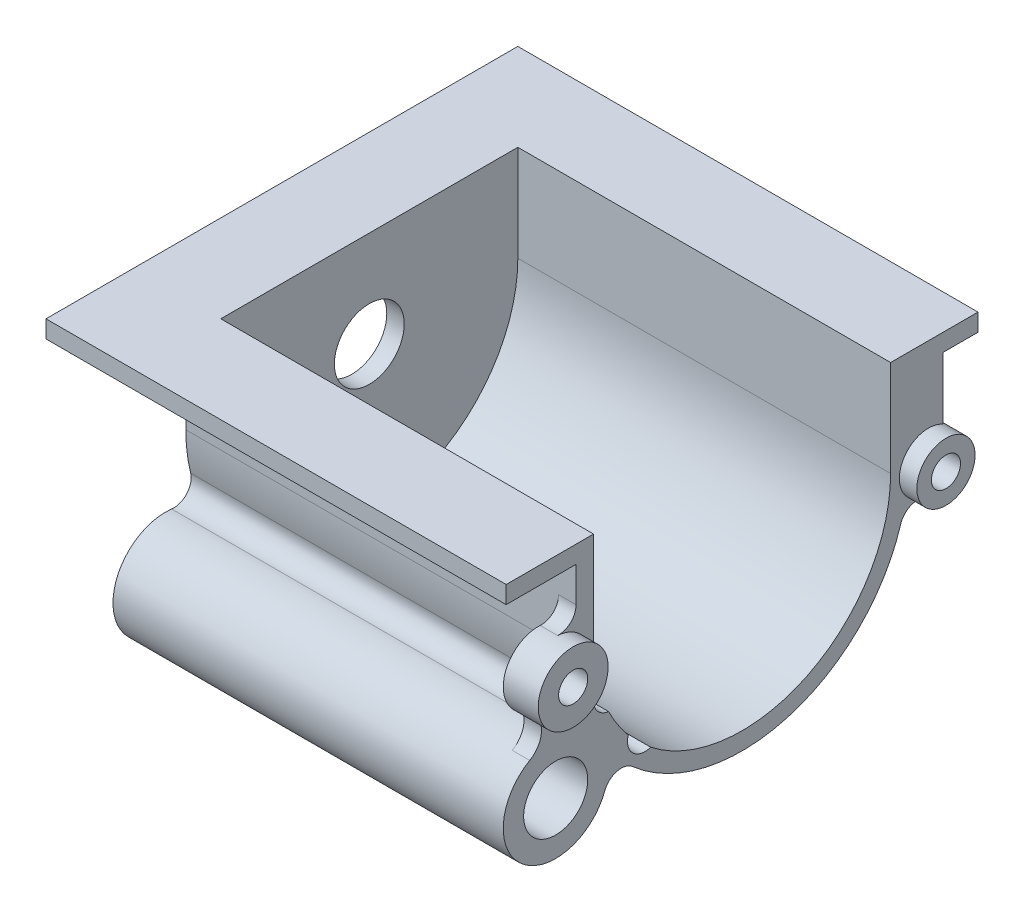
SolidWorks part; units mm, degrees
ref_plane "Front Plane" through (0, 0, 0) normal (0, 0, 1) x (1, 0, 0)
ref_plane "Top Plane" through (0, 0, 0) normal (0, 1, 0) x (1, 0, 0)
ref_plane "Right Plane" through (0, 0, 0) normal (1, 0, 0) x (0, 0, -1)
sketch "Sketch1" plane through (0, 0, 0) normal (1, 0, 0) x (0, 0, -1)
  line L0 (28.5, 0) -> (28.5, 16.5)
  line L1 (-28.5, 16.5) -> (28.5, 16.5)
  line L2 (-28.5, 0) -> (-28.5, 16.5)
  arc A0 (28.5, 0) -> (-28.5, 0) centre (0, 0) cw
  dimension "D1" = 45
  dimension "D2" = 28.5
extrude "Extrude1" add sketch "Sketch1" along normal blind 67
shell "Shell1" thickness 3
sketch "Sketch2" plane through (0, 16.5, 0) normal (0, 1, 0) x (-1, 0, 0)
  line L3 (-67, -25.5) -> (-67, -40.5)
  line L4 (-67, 25.5) -> (-67, 40.5)
  line L5 (-67, -28.5) -> (-67, -25.5) construction
  line L9 (12, 40.5) -> (-67, 40.5)
  line L10 (12, -40.5) -> (12, 40.5)
  line L11 (-67, -40.5) -> (12, -40.5)
  line L13 (0, -28.5) -> (0, 28.5)
  line L14 (0, 28.5) -> (-67, 28.5)
  line L15 (-67, 28.5) -> (-67, 25.5)
  line L16 (-67, -28.5) -> (0, -28.5)
  line L26 (-67, 25.5) -> (-3, 25.5)
  line L27 (-67, 25.5) -> (-3, 25.5)
  line L28 (-3, 25.5) -> (-3, -25.5)
  line L29 (-3, 25.5) -> (-3, -25.5)
  line L30 (-3, -25.5) -> (-67, -25.5)
  line L31 (-3, -25.5) -> (-67, -25.5)
  line L32 (-67, -25.5) -> (-67, -28.5)
  dimension "D1" = 15
  dimension "D3" = 15
  dimension "D4" = 15
  dimension "D2" = 0
extrude "Extrude2" add sketch "Sketch2" against normal blind 3
sketch "Sketch3" plane through (67, 0, 0) normal (1, 0, 0) x (0, 0, -1)
  line L0 (-25.5, 16.5) -> (-40.5, 16.5) construction
  line L1 (-28.5, 13.5) -> (-28.5, 0) construction
  line L2 (-28.5, 3.3734) -> (-28.5, 0)
  line L3 (0, 0) -> (-49.2554, 0) construction
  line L4 (0, 0) -> (-35.9674, -37.2453) construction
  line L5 (0, 0) -> (-49.5581, -18.0377) construction
  line L6 (-22.5526, -8.2085) -> (-49.2554, -8.2085) construction
  arc A0 (-28.5, 3.3734) -> (-34.672, -6.8722) centre (-32, -1.5) ccw
  arc A1 (-36.46, -11.6828) -> (-24.0176, -15.3429) centre (-32, -19.5) ccw
  circle A2 centre (0, 0) radius 24 construction
  circle A3 centre (-22.5526, -8.2085) radius 3 construction
  arc A4 (-28.5, 0) -> (28.5, 0) centre (0, 0) ccw construction
  arc A5 (-28.5, 0) -> (-24.0176, -15.3429) centre (0, 0) ccw
  arc A6 (-36.46, -11.6828) -> (-34.672, -6.8722) centre (-38.4422, -8.2085) ccw
  circle A7 centre (-16.6718, -17.2642) radius 3 construction
  dimension "D2" = 18
  dimension "D3" = 18
  dimension "D4" = 12
  dimension "D5" = 32
  dimension "D6" = 4
  dimension "D7" = 20
  dimension "D9" = 48
  dimension "D10" = 6
  dimension "D1" = 36
  dimension "D8" = 46
extrude "Extrude3" add sketch "Sketch3" against normal blind 3
sketch "Sketch4" plane through (67, 0, 0) normal (1, 0, 0) x (0, 0, -1)
  line L1 (34.5, 2.8301) -> (34.5, 13.5)
  line L2 (28.5, 13.5) -> (40.5, 13.5) construction
  line L3 (34.5, 13.5) -> (28.5, 13.5)
  line L5 (40.5, 13.5) -> (40.5, 16.5) construction
  line L6 (28.5, 0) -> (28.5, 13.5) construction
  line L7 (28.5, 0) -> (28.5, 13.5)
  arc A0 (28.1179, -4.6511) -> (34.5, 2.8301) centre (32, -1.5) ccw
  arc A2 (-24.0176, -15.3429) -> (28.5, 0) centre (0, 0) ccw construction
  arc A3 (28.1179, -4.6511) -> (28.5, 0) centre (0, 0) ccw
  dimension "D2" = 10
  dimension "D1" = 32
  dimension "D3" = 6
extrude "Extrude4" add sketch "Sketch4" against normal up to surface (3 mm away)
fillet "Fillet1" radius 3 3 edges at (65.5, -4.6511, -28.1179) (65.5, 3.3734, 28.5) (65.5, -15.3429, 24.0176)
sketch "Sketch5" plane through (67, 0, 0) normal (1, 0, 0) x (0, 0, -1)
  circle A0 centre (32, -1.5) radius 5
  circle A1 centre (-32, -1.5) radius 6
  arc A2 (-31.6667, 4.4907) -> (-34.672, -6.8722) centre (-32, -1.5) ccw construction
  arc A3 (30.8153, -6.3576) -> (34.5, 2.8301) centre (32, -1.5) ccw construction
extrude "Extrude5" add sketch "Sketch5" along normal blind 3
sketch "Sketch6" plane through (64, 0, 0) normal (-1, 0, 0) x (0, 0, 1)
  arc A0 (23.5676, -22.6455) -> (18.7799, -21.4374) centre (20.7568, -23.694) ccw construction
  arc A1 (23.5676, -22.6455) -> (36.46, -11.6828) centre (32, -19.5) ccw construction
  arc A2 (23.5676, -22.6455) -> (18.7799, -21.4374) centre (20.7568, -23.694) ccw
  arc A3 (23.5676, -22.6455) -> (30.9298, -10.5639) centre (32, -19.5) ccw
  arc A4 (18.7799, -21.4374) -> (28.5, 0) centre (0, 0) ccw construction
  arc A5 (18.7799, -21.4374) -> (27.6614, -6.8627) centre (0, 0) ccw
  arc A6 (30.9298, -10.5639) -> (27.6614, -6.8627) centre (30.5731, -7.5851) cw
extrude "Extrude6" add sketch "Sketch6" along normal up to surface (64 mm away)
sketch "Sketch7" plane through (67, 0, 0) normal (1, 0, 0) x (0, 0, -1)
  line L0 (-22.5526, -8.2085) -> (0, 0) construction
  line L1 (0, 0) -> (-16.6718, -17.2642) construction
  line L2 (0, 0) -> (-41.5049, 0) construction
  circle A0 centre (-22.5526, -8.2085) radius 3
  circle A2 centre (-16.6718, -17.2642) radius 3
  circle A3 centre (0, 0) radius 24 construction
  dimension "D3" = 48
  dimension "D4" = 6
  dimension "D1" = 20
  dimension "D2" = 46
extrude "Cut-Extrude1" cut sketch "Sketch7" against normal up to surface (64 mm away)
hole_wizard "M5.0 (5) Diameter Hole1" positions "Sketch9" profile "Sketch8" hole size "M5.0" standard "Ansi Metric"
sketch "Sketch9" plane through (70, 0, 0) normal (1, 0, 0) x (0, 0, -1)
  point P0 (-32, -1.5)
  point P1 (32, -1.5)
sketch "Sketch8" plane through (70, -1.5, 32) normal (0, 1, 0) x (0, 0, -1)
  line L0 (0, 0) -> (0, 82)
  line L1 (0, 82) -> (2.5, 82)
  line L2 (2.5, 82) -> (2.5, 0)
  line L5 (2.5, 0) -> (0, 0)
  line L11 (0, -6.35) -> (0, 107.95) construction
  dimension "Thru Hole Dia." = 5
  dimension "Thru Hole Depth" = 82
hole_wizard "M11.0 (11) Diameter Hole1" positions "Sketch11" profile "Sketch10" hole size "M11.0" standard "Ansi Metric"
sketch "Sketch11" plane through (67, 0, 0) normal (1, 0, 0) x (0, 0, -1)
  point P0 (-32, -19.5)
sketch "Sketch10" plane through (67, -19.5, 32) normal (0, 1, 0) x (0, 0, -1)
  line L0 (0, 0) -> (0, 79)
  line L1 (0, 79) -> (5.5, 79)
  line L2 (5.5, 79) -> (5.5, 0)
  line L5 (5.5, 0) -> (0, 0)
  line L11 (0, -6.35) -> (0, 107.95) construction
  dimension "Thru Hole Dia." = 11
  dimension "Thru Hole Depth" = 79
hole_wizard "M12.0 (12) Diameter Hole1" positions "Sketch14" profile "Sketch13" hole size "M12.0" standard "Ansi Metric"
sketch "Sketch14" plane through (3, 0, 0) normal (1, 0, 0) x (0, 0, -1)
  point P0 (0, 0)
sketch "Sketch13" plane through (3, 0, 0) normal (0, 1, 0) x (0, 0, -1)
  line L0 (0, 0) -> (0, 15)
  line L1 (0, 15) -> (6, 15)
  line L2 (6, 15) -> (6, 0)
  line L5 (6, 0) -> (0, 0)
  line L11 (0, -6.35) -> (0, 107.95) construction
  dimension "Thru Hole Dia." = 12
  dimension "Thru Hole Depth" = 15
